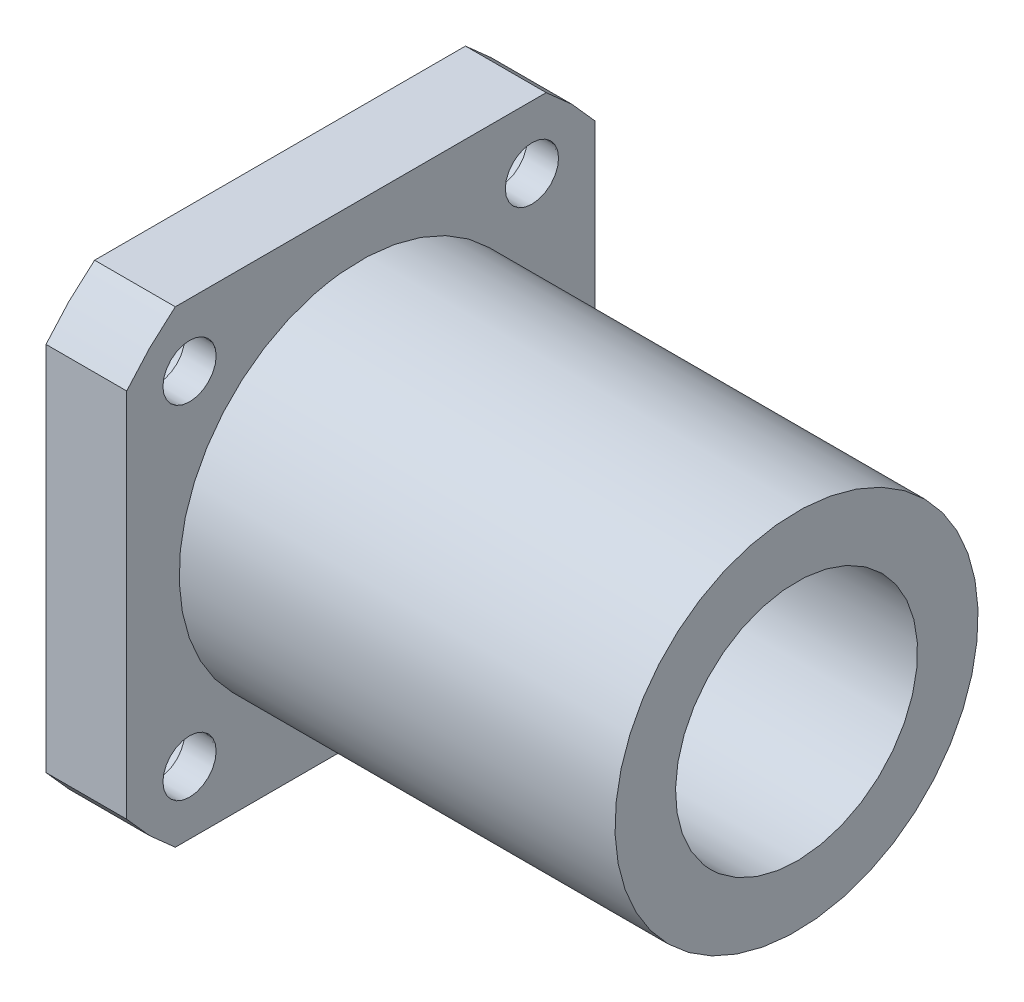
SolidWorks part; units mm, degrees
other "Solid1"
ref_plane "Front Plane" through (0, 0, 0) normal (0, 0, 1) x (1, 0, 0)
ref_plane "Top Plane" through (0, 0, 0) normal (0, 1, 0) x (1, 0, 0)
ref_plane "Right Plane" through (0, 0, 0) normal (1, 0, 0) x (0, 0, -1)
imported_body "2.7052 LMK30UU.stp<1>"
move or copy body "Body-Move/Copy1" bodies to move or copy 101 copy no rotation origin (0, 0, 0) rotation axis (1, 0, 0) rotation angle 45
